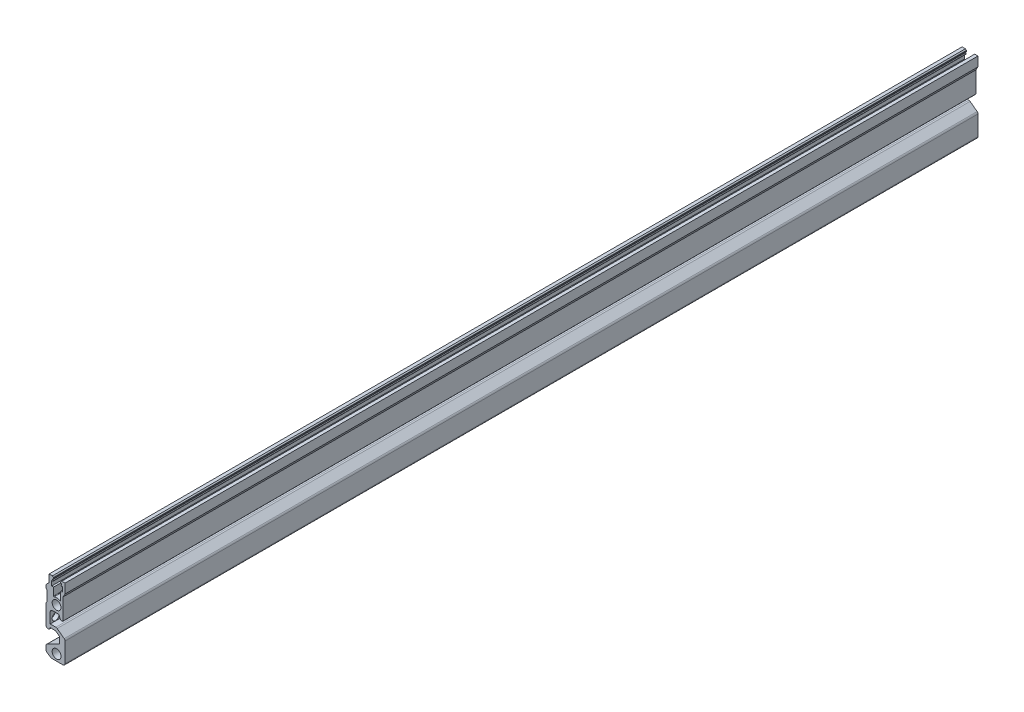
SolidWorks part; units mm, degrees
ref_plane "前视基准面" through (0, 0, 0) normal (0, 0, 1) x (1, 0, 0)
ref_plane "上视基准面" through (0, 0, 0) normal (0, 1, 0) x (1, 0, 0)
ref_plane "右视基准面" through (0, 0, 0) normal (1, 0, 0) x (0, 0, -1)
sketch "草图1" plane through (0, 0, 0) normal (0, 0, 1) x (1, 0, 0)
  line L0 (-2.3509, 8.9116) -> (-2.3509, 6.6116)
  line L1 (-2.3509, 8.9116) -> (-1.4509, 8.9116)
  line L2 (-1.4509, 8.9116) -> (-1.4509, 11.7916)
  line L3 (-1.4509, 11.7916) -> (-4.1259, 11.7916)
  line L4 (-4.1259, 11.7916) -> (-4.1259, 10.0616)
  line L5 (-4.1259, 10.0616) -> (-3.5009, 9.8916)
  line L6 (-3.5009, 9.8916) -> (-3.5009, 8.5216)
  line L7 (-3.5009, 8.5216) -> (-5.0009, 8.5216)
  line L8 (-5.0009, 8.5216) -> (-5.0009, 4.4416)
  line L9 (-5.0009, 4.4416) -> (-4.5507, 3.9414)
  line L10 (-4.5507, 3.9414) -> (-4.551, -1.0586)
  line L11 (-4.551, -1.0586) -> (-5.0009, -1.5584)
  line L12 (-5.0009, -1.5584) -> (-5.0009, -10.75)
  line L13 (-3.0009, -9.25) -> (-3.0009, -5.75)
  line L14 (2.9991, -5.05) -> (2.9991, -2.0584)
  line L15 (3.2991, -1.7584) -> (3.6991, -1.7584)
  line L16 (3.9991, -2.0584) -> (3.9991, -3.4584)
  line L17 (4.2991, -3.7584) -> (4.6991, -3.7584)
  line L18 (4.9991, -3.4584) -> (4.9991, 2.6416)
  line L19 (4.6991, 2.9416) -> (4.2991, 2.9416)
  line L20 (3.9991, 2.6416) -> (3.9991, 1.2416)
  line L21 (3.6991, 0.9416) -> (3.2991, 0.9416)
  line L22 (2.9991, 1.2416) -> (2.9991, 4.8054)
  line L23 (2.9991, 4.8054) -> (3.9991, 6.5374)
  line L24 (3.9991, 6.5374) -> (3.9991, 9.5216)
  line L25 (3.9991, 9.5216) -> (3.1241, 9.5216)
  line L26 (3.1241, 10.7916) -> (3.1241, 11.7916)
  line L27 (3.1241, 11.7916) -> (1.9491, 11.7916)
  line L28 (1.9491, 11.7916) -> (1.9491, 8.9116)
  line L29 (1.9491, 8.9116) -> (2.8491, 8.9116)
  line L30 (2.8491, 6.6116) -> (2.8491, 8.9116)
  line L31 (2.8491, 6.6116) -> (1.9491, 6.6116)
  line L32 (1.9491, 6.6116) -> (1.9491, 2.6797)
  line L33 (-1.4509, 2.9454) -> (-1.4509, 6.6116)
  line L34 (-1.4509, 6.6116) -> (-2.3509, 6.6116)
  line L35 (0, 0) -> (0, -5) construction
  line L39 (-2.5009, -5.25) -> (2.7991, -5.25)
  line L40 (-1.4509, 10.3516) -> (1.9491, 10.3516) construction
  line L41 (-3.0009, -10.75) -> (-5.0009, -10.75) construction
  line L42 (0.2491, 10.3516) -> (0.2491, 6.8507) construction
  line L43 (1.4991, -10.75) -> (1.4991, -17.25)
  line L44 (2.9991, -10.05) -> (2.9991, -22.2)
  line L45 (-3.0009, -10.75) -> (1.4991, -10.75)
  line L46 (-3.0009, -9.25) -> (2.1991, -9.25)
  line L47 (-5.0009, -22.2) -> (-5.0009, -18.05)
  line L48 (2.1991, -23) -> (-4.2009, -23)
  line L49 (-4.2009, -17.25) -> (1.4991, -17.25)
  arc A1 (3.2991, -1.7584) -> (2.9991, -2.0584) centre (3.2991, -2.0584) ccw
  arc A2 (3.9991, -2.0584) -> (3.6991, -1.7584) centre (3.6991, -2.0584) ccw
  arc A3 (3.9991, -3.4584) -> (4.2991, -3.7584) centre (4.2991, -3.4584) ccw
  arc A4 (4.6991, -3.7584) -> (4.9991, -3.4584) centre (4.6991, -3.4584) ccw
  arc A5 (4.9991, 2.6416) -> (4.6991, 2.9416) centre (4.6991, 2.6416) ccw
  arc A6 (4.2991, 2.9416) -> (3.9991, 2.6416) centre (4.2991, 2.6416) ccw
  arc A7 (3.6991, 0.9416) -> (3.9991, 1.2416) centre (3.6991, 1.2416) ccw
  arc A8 (2.9991, 1.2416) -> (3.2991, 0.9416) centre (3.2991, 1.2416) ccw
  arc A9 (3.1241, 10.7916) -> (3.1241, 9.5216) centre (3.1841, 10.1566) ccw
  circle A10 centre (0, 0) radius 1.6
  arc A11 (1.6398, 2.5122) -> (-1.1727, 2.7613) centre (0, 0) ccw
  arc A12 (1.6398, 2.5122) -> (1.9491, 2.6797) centre (1.7491, 2.6797) ccw
  arc A13 (-1.4509, 2.9454) -> (-1.1727, 2.7613) centre (-1.2509, 2.9454) ccw
  arc A17 (-4.2009, -17.25) -> (-5.0009, -18.05) centre (-4.2009, -18.05) ccw
  arc A18 (2.1991, -23) -> (2.9991, -22.2) centre (2.1991, -22.2) ccw
  arc A19 (2.7991, -5.25) -> (2.9991, -5.05) centre (2.7991, -5.05) ccw
  arc A20 (-3.0009, -5.75) -> (-2.5009, -5.25) centre (-2.5009, -5.75) cw
  circle A21 centre (0, -20) radius 1.6
  arc A22 (-5.0009, -22.2) -> (-4.2009, -23) centre (-4.2009, -22.2) ccw
  arc A23 (2.9991, -10.05) -> (2.1991, -9.25) centre (2.1991, -10.05) ccw
  arc A28 (-5.0009, -10.75) -> (-3.0009, -10.75) centre (-4.0009, -10.75) ccw
  dimension "D3" = 1.5
  dimension "D6" = 3.2
  dimension "D7" = 20
  dimension "D17" = 0.8
  dimension "D18" = 0.8
  dimension "D19" = 0.8
  dimension "D20" = 0.8
  dimension "D5" = 5.2
  dimension "D8" = 1
  dimension "D10" = 34.7916
  dimension "D12" = 5.75
  dimension "D13" = 13.75
  dimension "D16" = 8
extrude "凸台-拉伸1" add sketch "草图1" along normal mid plane 431.8
sketch "草图2" plane through (0, 0, -215.9) normal (0, 0, -1) x (-1, 0, 0)
  circle A0 centre (0, 0) radius 2.1
  circle A1 centre (0, -20) radius 2.1
  dimension "D1" = 4.2
  dimension "D2" = 4.2
extrude "切除-拉伸1" cut sketch "草图2" against normal blind 10
sketch "草图3" plane through (0, 0, 215.9) normal (0, 0, 1) x (1, 0, 0)
  circle A0 centre (0, 0) radius 2.1
  circle A1 centre (0, -20) radius 2.1
  dimension "D1" = 4.2
  dimension "D2" = 4.2
extrude "切除-拉伸2" cut sketch "草图3" against normal blind 10
sketch "草图4" plane through (-5.0009, 0, 0) normal (-1, 0, 0) x (0, 0, 1)
  line L0 (-215.9, -1.5584) -> (-215.9, -10.75) construction
  line L2 (-215.9, -11.75) -> (215.9, -11.75) construction
  circle A0 centre (-213.36, -7.5) radius 1.65
  circle A1 centre (-208.28, -7.5) radius 1.65
  circle A2 centre (-203.2, -7.5) radius 1.65
  circle A3 centre (-198.12, -7.5) radius 1.65
  circle A4 centre (-193.04, -7.5) radius 1.65
  circle A5 centre (-187.96, -7.5) radius 1.65
  circle A6 centre (-182.88, -7.5) radius 1.65
  circle A7 centre (-177.8, -7.5) radius 1.65
  circle A8 centre (-172.72, -7.5) radius 1.65
  circle A9 centre (-167.64, -7.5) radius 1.65
  circle A10 centre (-162.56, -7.5) radius 1.65
  circle A11 centre (-157.48, -7.5) radius 1.65
  circle A12 centre (-152.4, -7.5) radius 1.65
  circle A13 centre (-147.32, -7.5) radius 1.65
  circle A14 centre (-142.24, -7.5) radius 1.65
  circle A15 centre (-137.16, -7.5) radius 1.65
  circle A16 centre (-132.08, -7.5) radius 1.65
  circle A17 centre (-127, -7.5) radius 1.65
  circle A18 centre (-121.92, -7.5) radius 1.65
  circle A19 centre (-116.84, -7.5) radius 1.65
  circle A20 centre (-111.76, -7.5) radius 1.65
  circle A21 centre (-106.68, -7.5) radius 1.65
  circle A22 centre (-101.6, -7.5) radius 1.65
  circle A23 centre (-96.52, -7.5) radius 1.65
  circle A24 centre (-91.44, -7.5) radius 1.65
  circle A25 centre (-86.36, -7.5) radius 1.65
  circle A26 centre (-81.28, -7.5) radius 1.65
  circle A27 centre (-76.2, -7.5) radius 1.65
  circle A28 centre (-71.12, -7.5) radius 1.65
  circle A29 centre (-66.04, -7.5) radius 1.65
  circle A30 centre (-60.96, -7.5) radius 1.65
  circle A31 centre (-55.88, -7.5) radius 1.65
  circle A32 centre (-50.8, -7.5) radius 1.65
  circle A33 centre (-45.72, -7.5) radius 1.65
  circle A34 centre (-40.64, -7.5) radius 1.65
  circle A35 centre (-35.56, -7.5) radius 1.65
  circle A36 centre (-30.48, -7.5) radius 1.65
  circle A37 centre (-25.4, -7.5) radius 1.65
  circle A38 centre (-20.32, -7.5) radius 1.65
  circle A39 centre (-15.24, -7.5) radius 1.65
  circle A40 centre (-10.16, -7.5) radius 1.65
  circle A41 centre (-5.08, -7.5) radius 1.65
  circle A42 centre (0, -7.5) radius 1.65
  circle A43 centre (5.08, -7.5) radius 1.65
  circle A44 centre (10.16, -7.5) radius 1.65
  circle A45 centre (15.24, -7.5) radius 1.65
  circle A46 centre (20.32, -7.5) radius 1.65
  circle A47 centre (25.4, -7.5) radius 1.65
  circle A48 centre (30.48, -7.5) radius 1.65
  circle A49 centre (35.56, -7.5) radius 1.65
  circle A50 centre (40.64, -7.5) radius 1.65
  circle A51 centre (45.72, -7.5) radius 1.65
  circle A52 centre (50.8, -7.5) radius 1.65
  circle A53 centre (55.88, -7.5) radius 1.65
  circle A54 centre (60.96, -7.5) radius 1.65
  circle A55 centre (66.04, -7.5) radius 1.65
  circle A56 centre (71.12, -7.5) radius 1.65
  circle A57 centre (76.2, -7.5) radius 1.65
  circle A58 centre (81.28, -7.5) radius 1.65
  circle A59 centre (86.36, -7.5) radius 1.65
  circle A60 centre (91.44, -7.5) radius 1.65
  circle A61 centre (96.52, -7.5) radius 1.65
  circle A62 centre (101.6, -7.5) radius 1.65
  circle A63 centre (106.68, -7.5) radius 1.65
  circle A64 centre (111.76, -7.5) radius 1.65
  circle A65 centre (116.84, -7.5) radius 1.65
  circle A66 centre (121.92, -7.5) radius 1.65
  circle A67 centre (127, -7.5) radius 1.65
  circle A68 centre (132.08, -7.5) radius 1.65
  circle A69 centre (137.16, -7.5) radius 1.65
  circle A70 centre (142.24, -7.5) radius 1.65
  circle A71 centre (147.32, -7.5) radius 1.65
  circle A72 centre (152.4, -7.5) radius 1.65
  circle A73 centre (157.48, -7.5) radius 1.65
  circle A74 centre (162.56, -7.5) radius 1.65
  circle A75 centre (167.64, -7.5) radius 1.65
  circle A76 centre (172.72, -7.5) radius 1.65
  circle A77 centre (177.8, -7.5) radius 1.65
  circle A78 centre (182.88, -7.5) radius 1.65
  circle A79 centre (187.96, -7.5) radius 1.65
  circle A80 centre (193.04, -7.5) radius 1.65
  circle A81 centre (198.12, -7.5) radius 1.65
  circle A82 centre (203.2, -7.5) radius 1.65
  circle A83 centre (208.28, -7.5) radius 1.65
  circle A84 centre (213.36, -7.5) radius 1.65
  dimension "D1" = 3.3
  dimension "D5" = 5.08
  dimension "D3" = 4.25
  dimension "D2" = 2.54
  dimension "D4" = 85
extrude "切除-拉伸3" cut sketch "草图4" against normal blind 12
sketch "草图5" plane through (0, 0, 215.9) normal (0, 0, 1) x (1, 0, 0)
  line L0 (1.9491, 8.9116) -> (2.8491, 8.9116) construction
  line L1 (1.9491, 8.9116) -> (3.9991, 8.9116)
  line L2 (1.9491, 8.9116) -> (1.9491, 11.7916)
  line L3 (1.9491, 11.7916) -> (3.9991, 11.7916)
  line L4 (3.9991, 8.9116) -> (3.9991, 11.7916)
  line L5 (3.1241, 11.7916) -> (1.9491, 11.7916) construction
  line L6 (3.9991, 6.5374) -> (3.9991, 9.5216) construction
  line L7 (-1.4509, 11.7916) -> (-4.1259, 11.7916) construction
  line L8 (-5.0009, 8.5216) -> (-2.7884, 8.5216)
  line L9 (-5.0009, 8.5216) -> (-5.0009, 11.7916)
  line L10 (-5.0009, 11.7916) -> (-2.7884, 11.7916)
  line L11 (-2.7884, 8.5216) -> (-2.7884, 11.7916)
extrude "凸台-拉伸2" add sketch "草图5" against normal up to surface (431.8 mm away)
sketch "草图6" plane through (0, 0, -215.9) normal (0, 0, -1) x (-1, 0, 0)
  line L0 (-1.9491, 9.4916) -> (1.4509, 9.4916) construction
  line L1 (-1.9491, 11.7916) -> (-1.9491, 8.9116) construction
  line L2 (1.4509, 8.9116) -> (1.4509, 11.7916) construction
  line L3 (1.4509, 11.7916) -> (5.0009, 11.7916) construction
  line L4 (-2.3491, 8.9916) -> (1.8509, 8.9916)
  line L5 (-2.3491, 8.9916) -> (-2.3491, 9.9916)
  line L6 (-2.3491, 9.9916) -> (1.8509, 9.9916)
  line L7 (1.8509, 8.9916) -> (1.8509, 9.9916)
  line L8 (-2.3491, 8.9916) -> (1.8509, 9.9916) construction
  line L9 (-2.3491, 9.9916) -> (1.8509, 8.9916) construction
  point P6 (-0.2491, 9.4916)
  dimension "D1" = 1
  dimension "D2" = 4.2
  dimension "D3" = 1.8
extrude "切除-拉伸4" cut sketch "草图6" against normal through all
sketch "草图8" plane through (0, 0, -215.9) normal (0, 0, -1) x (-1, 0, 0)
  line L0 (5.0009, 11.7916) -> (5.0009, 4.4416) construction
  line L1 (-3.9991, 11.7916) -> (5.0009, 11.7916)
  line L2 (-3.9991, 11.7916) -> (-3.9991, 11.0016)
  line L3 (-3.9991, 11.0016) -> (5.0009, 11.0016)
  line L4 (5.0009, 11.7916) -> (5.0009, 11.0016)
  dimension "D1" = 0.79
extrude "切除-拉伸6" cut sketch "草图8" against normal through all
fillet "圆角1" radius 0.5 4 edges at (-1.8509, 9.9916, 0) (-1.8509, 8.9916, 0) (2.3491, 9.9916, 0) (2.3491, 8.9916, 0)
chamfer "倒角1" distance 0.5 angle 45 2 edges at (-1.4509, 11.0016, 0) (1.9491, 11.0016, 0)
fillet "圆角2" radius 0.2 6 edges at (1.9491, 10.5016, 0) (-1.4509, 10.5016, 0) (-1.4509, 8.9916, 0) (-1.4509, 9.9916, 0) (1.9491, 8.9916, 0) (1.9491, 9.9916, 0)
fillet "圆角3" radius 0.1 2 edges at (-1.4509, 8.9116, 0) (1.9491, 8.9116, 0)
sketch "草图7" plane through (0, 0, -215.9) normal (0, 0, -1) x (-1, 0, 0)
  line L0 (5.0009, 11.0016) -> (3.5009, 11.0016)
  line L2 (3.5009, 11.0016) -> (3.5009, 7.4416)
  line L3 (3.5009, 7.4416) -> (5.0009, 5.9416)
  line L4 (5.0009, 11.0016) -> (5.0009, 4.4416) construction
  line L5 (5.0009, 5.9416) -> (5.0009, 11.0016)
  line L6 (1.4509, 10.1341) -> (1.4509, 10.4187) construction
  line L7 (1.9509, 11.0016) -> (5.0009, 11.0016) construction
  dimension "D1" = 2.05
  dimension "D2" = 1.5
  dimension "D3" = 45
extrude "切除-拉伸5" cut sketch "草图7" against normal through all
sketch "草图10" plane through (0, 0, -215.9) normal (0, 0, -1) x (-1, 0, 0)
  line L0 (5.0009, -19.75) -> (1.0009, -23)
  line L3 (5.0009, -18.05) -> (5.0009, -22.2) construction
  line L4 (4.2009, -23) -> (-2.1991, -23) construction
  line L5 (1.0009, -23) -> (6.263, -23)
  line L6 (6.263, -23) -> (6.263, -19.75)
  line L7 (6.263, -19.75) -> (5.0009, -19.75)
  line L8 (-1.4991, -17.25) -> (4.2009, -17.25) construction
  dimension "D1" = 2.5
  dimension "D2" = 4
extrude "切除-拉伸7" [suppressed] cut sketch "草图10" against normal through all
fillet "圆角4" [suppressed] radius 0.8
sketch "草图11" plane through (0, 0, -215.9) normal (0, 0, -1) x (-1, 0, 0)
  line L2 (5.0009, -18.05) -> (5.0009, -22.2) construction
  line L7 (5.0009, -21.375) -> (5.0009, -23)
  line L8 (5.0009, -23) -> (2.5009, -23)
  line L9 (4.2009, -23) -> (-2.1991, -23) construction
  line L10 (2.5009, -23) -> (5.0009, -21.375)
  line L11 (5.0009, -20.125) -> (-2.9991, -20.125) construction
  line L12 (-2.9991, -22.2) -> (-2.9991, -10.05) construction
  line L13 (3.0009, -6.25) -> (3.0009, -3.25)
  line L14 (3.0009, -9.25) -> (3.0009, -5.75) construction
  line L15 (3.0009, -3.25) -> (-1.4991, -3.25)
  line L16 (-1.4991, -3.25) -> (-1.4991, -6.25)
  line L17 (3.0009, -6.25) -> (-1.4991, -6.25)
  line L18 (2.5009, -5.25) -> (-2.7991, -5.25) construction
  line L20 (-2.9991, -5.05) -> (-2.9991, -2.0584) construction
  dimension "D1" = 1.625
  dimension "D4" = 5.5
  dimension "D5" = 2
  dimension "D6" = 3
  dimension "D7" = 1.5
extrude "切除-拉伸8" cut sketch "草图11" against normal through all
sketch "草图12" plane through (0, 0, -215.9) normal (0, 0, -1) x (-1, 0, 0)
  line L0 (2.5009, -17.25) -> (-1.4991, -17.25)
  line L1 (-1.4991, -17.25) -> (-1.4991, -15.25)
  line L2 (-1.4991, -15.25) -> (2.5009, -17.25)
  line L3 (0.5009, -10.75) -> (-1.4991, -12.25)
  line L4 (3.0009, -10.75) -> (-1.4991, -10.75) construction
  line L5 (-1.4991, -10.75) -> (-1.4991, -17.25) construction
  line L6 (-1.4991, -12.25) -> (-1.4991, -10.75)
  line L7 (-1.4991, -10.75) -> (0.5009, -10.75)
  dimension "D1" = 2
  dimension "D2" = 1.5
  dimension "D3" = 2
extrude "凸台-拉伸3" add sketch "草图12" against normal through all
sketch "草图14" plane through (0, 0, -215.9) normal (0, 0, -1) x (-1, 0, 0)
  line L0 (0.0009, -9.25) -> (-2.9991, -11.5)
  line L1 (-2.1991, -9.25) -> (3.0009, -9.25) construction
  line L2 (-2.9991, -22.2) -> (-2.9991, -10.05) construction
  line L3 (-2.9991, -11.5) -> (-2.9991, -9.25)
  line L4 (-2.9991, -9.25) -> (0.0009, -9.25)
  line L5 (-1.4991, -12.25) -> (0.5009, -10.75) construction
  line L6 (2.5009, -17.25) -> (5.961, -18.98)
  line L7 (5.961, -18.98) -> (5.961, -16.25)
  line L8 (5.961, -16.25) -> (2.5009, -17.25)
  dimension "D1" = 1.5
extrude "切除-拉伸10" cut sketch "草图14" against normal through all
fillet "圆角6" radius 1 10 edges at (-5.0009, -21.375, 0) (-5.0009, -18.5, 0) (1.4991, -15.25, 0) (-2.5009, -23, 0) (-0.5009, -10.75, 0) (2.9991, -11.5, 0) (-0.0009, -9.25, 0) (-3.0009, -3.25, 0) (1.4991, -3.25, 0) (1.4991, -5.25, 0)
sketch "草图15" plane through (0, 0, -215.9) normal (0, 0, -1) x (-1, 0, 0)
  line L0 (-2.1991, -23) -> (-2.9991, -23)
  line L1 (-2.9991, -23) -> (-2.9991, -22.2)
  line L2 (-2.9991, -22.2) -> (-2.1991, -23)
  line L3 (2.2044, -23) -> (-2.1991, -23) construction
  line L4 (-2.9991, -12) -> (-2.5991, -11.2)
  line L5 (-2.5991, -11.2) -> (-2.9991, -11.5)
  line L6 (-2.9991, -12) -> (-2.9991, -11.5)
extrude "凸台-拉伸4" add sketch "草图15" against normal through all
sketch "草图16" plane through (0, 0, -215.9) normal (0, 0, -1) x (-1, 0, 0)
  line L0 (-2.9991, -11.5) -> (-3.9991, -12.25)
  line L1 (-2.9991, -23) -> (-3.9991, -23)
  line L2 (-2.9991, -23) -> (-2.9991, -11.5)
  line L3 (-2.9991, -11.5) -> (-0.2658, -9.45) construction
  line L4 (-3.9991, -23) -> (-3.9991, -12.25)
  dimension "D1" = 1
extrude "凸台-拉伸5" add sketch "草图16" against normal through all
fillet "圆角7" radius 1 2 edges at (3.9991, -12.25, 0) (3.9991, -23, 0)
sketch "草图17" plane through (0, 0, -215.9) normal (0, 0, -1) x (-1, 0, 0)
  line L0 (-2.9991, -5.05) -> (-2.9991, -2.0584) construction
  line L1 (-2.9991, -6.1776) -> (-6.0043, -6.1776)
  line L2 (-2.9991, -6.1776) -> (-2.9991, 3.4413)
  line L3 (-2.9991, 3.4413) -> (-6.0043, 3.4413)
  line L4 (-6.0043, -6.1776) -> (-6.0043, 3.4413)
  line L5 (-2.9991, 1.2416) -> (-2.9991, 4.8054) construction
extrude "切除-拉伸11" cut sketch "草图17" against normal through all
